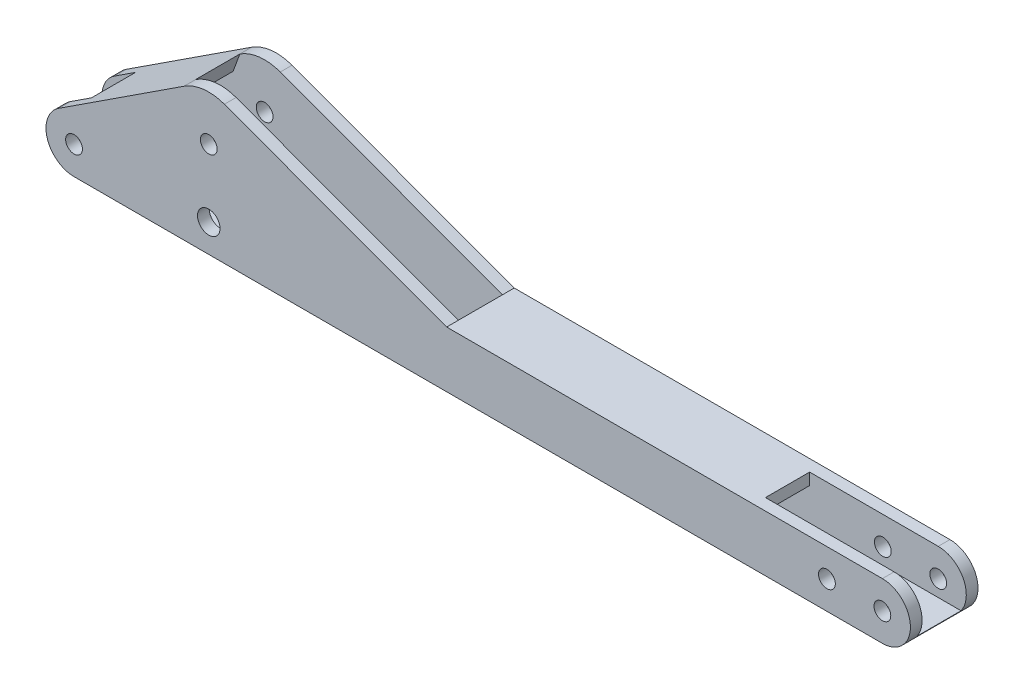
SolidWorks part; units mm, degrees
ref_plane "Front Plane" through (0, 0, 0) normal (0, 0, 1) x (1, 0, 0)
ref_plane "Top Plane" through (0, 0, 0) normal (0, 1, 0) x (1, 0, 0)
ref_plane "Right Plane" through (0, 0, 0) normal (1, 0, 0) x (0, 0, -1)
sketch "Sketch1" plane through (0, 0, 0) normal (0, 0, 1) x (1, 0, 0)
  line L0 (0, 0) -> (0, 305) construction
  line L1 (-679.4149, 106.3512) -> (-112.0477, 476.6692)
  line L2 (-610, -127) -> (2799, -127)
  line L3 (2799, -127) -> (3050, -127)
  line L4 (3050, 127) -> (1077.1082, 127)
  line L5 (1077.1082, 127) -> (70.8091, 497.3826)
  circle A0 centre (-610, 0) radius 127
  circle A1 centre (0, 305) radius 205
  circle A2 centre (3050, 0) radius 127
  circle A3 centre (-610, 0) radius 38
  circle A4 centre (0, 305) radius 38
  circle A5 centre (3050, 0) radius 38
  circle A6 centre (2799, 0) radius 38
  circle A7 centre (0, 0) radius 51
  dimension "D1" = 254
  dimension "D4" = 410
  dimension "D7" = 254
  dimension "D10" = 76
  dimension "D11" = 102
  dimension "D2" = 610
  dimension "D3" = 305
  dimension "D5" = 3409
  dimension "D6" = 251
  dimension "D8" = 127
  dimension "D9" = 1239.5
extrude "Boss-Extrude1" add sketch "Sketch1" along normal mid plane 306
sketch "Sketch2" plane through (0, 0, 0) normal (0, 0, 1) x (1, 0, 0)
  line L0 (-142.7083, 393.3668) -> (-555.5316, 123.9189)
  line L1 (-310.6232, -74) -> (3153.2134, -74)
  line L2 (2467.6008, 74) -> (1057.6008, 74)
  line L4 (1077.1082, 127) -> (70.8091, 497.3826)
  line L5 (-112.0477, 476.6692) -> (-679.4149, 106.3512)
  line L6 (-610, -127) -> (3050, -127)
  line L7 (3050, 127) -> (1077.1082, 127)
  line L8 (1077.1082, 127) -> (70.8091, 497.3826)
  line L9 (-112.0477, 476.6692) -> (-679.4149, 106.3512)
  line L10 (-610, -127) -> (3050, -127)
  line L11 (3050, 127) -> (1077.1082, 127)
  line L13 (-83.0793, 432.2864) -> (-650.4465, 61.9684) construction
  line L14 (-555.5316, 123.9189) -> (-584.5, 168.3017)
  line L15 (-679.4149, 106.3512) -> (-112.0477, 476.6692) construction
  line L16 (1077.1082, 127) -> (1057.6008, 74)
  line L17 (3050, 74) -> (1077.1082, 74) construction
  line L18 (-112.0477, 476.6692) -> (-142.7083, 393.3668)
  line L19 (2467.6008, 74) -> (2467.6008, 127)
  line L20 (-610, -74) -> (3050, -74) construction
  line L21 (-310.6232, -74) -> (-391.825, -127)
  arc A0 (3050, -127) -> (3050, 127) centre (3050, 0) ccw construction
  arc A3 (70.8091, 497.3826) -> (-112.0477, 476.6692) centre (0, 305) ccw
  arc A4 (-679.4149, 106.3512) -> (-610, -127) centre (-610, 0) ccw
  arc A5 (3050, -127) -> (3050, 127) centre (3050, 0) ccw
  arc A6 (70.8091, 497.3826) -> (-112.0477, 476.6692) centre (0, 305) ccw
  arc A7 (-679.4149, 106.3512) -> (-610, -127) centre (-610, 0) ccw
  arc A8 (3050, -127) -> (3050, 127) centre (3050, 0) ccw
  dimension "D3" = 25.5
  dimension "D4" = 1410
  dimension "D5" = 299.6
  dimension "D1" = 0
  dimension "D2" = 53
extrude "Cut-Extrude1" cut sketch "Sketch2" against normal mid plane 200 contours L1 A8 L11 L19 L2 L16 L8 A6 L18 L0 L14 L9 A7 L10 L21
